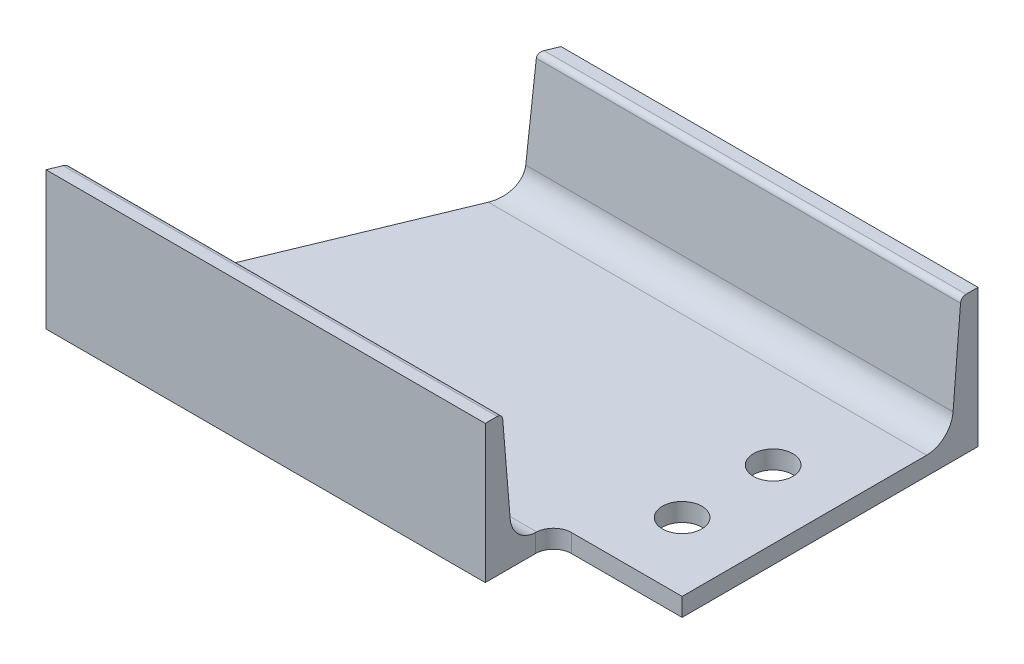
SolidWorks part; units mm, degrees
ref_plane "Front Plane" through (0, 0, 0) normal (0, 0, 1) x (1, 0, 0)
ref_plane "Top Plane" through (0, 0, 0) normal (0, 1, 0) x (1, 0, 0)
ref_plane "Right Plane" through (0, 0, 0) normal (1, 0, 0) x (0, 0, -1)
ref_plane "Member Plane" through (0, 0, 0) normal (0, 1, 0) x (-1, 0, 0)
sketch "Member Sketch" plane through (0, 0, 0) normal (0, 1, 0) x (1, 0, 0)
  line L0 (0, 0) -> (345, 0)
  line L2 (0, 0) -> (345, 0) construction
other "Structural Member1"
ref_plane "Plane1" through (0, 0, -101.6) normal (1, 0, 0) x (0, 1, 0)
sketch "Sketch1" plane through (0, 0, -101.6) normal (1, 0, 0) x (0, 1, 0)
  line L0 (0, 101.6) -> (0, -101.6)
  line L1 (76.962, 0) -> (0, 0) construction
  line L2 (0, 101.6) -> (76.962, 101.6)
  line L3 (74.1364, 91.8509) -> (23.7715, 87.6826)
  line L4 (10.16, 72.898) -> (10.16, -72.898)
  line L5 (76.962, 101.6) -> (76.962, 94.92)
  line L6 (76.962, -101.6) -> (76.962, -94.92)
  line L7 (74.1364, -91.8509) -> (23.7715, -87.6826)
  line L8 (0, -101.6) -> (76.962, -101.6)
  line L9 (38.481, 101.6) -> (38.481, -101.6) construction
  line L11 (76.962, 92.0848) -> (76.962, -92.0848) construction
  arc A0 (10.16, -72.898) -> (23.7715, -87.6826) centre (24.9952, -72.898) ccw
  arc A1 (10.16, 72.898) -> (23.7715, 87.6826) centre (24.9952, 72.898) cw
  arc A2 (76.962, -94.92) -> (74.1364, -91.8509) centre (73.8824, -94.92) ccw
  arc A3 (74.1364, 91.8509) -> (76.962, 94.92) centre (73.8824, 94.92) ccw
  point P2 (38.481, 88.9)
  point P10 (10.16, 0)
  point P17 (0, 0)
  point P19 (10.16, -101.6)
  point P20 (0, -85.7152)
  point P21 (0, 85.7152)
  point P22 (10.16, 101.6)
  point P31 (38.481, 0)
  dimension "D1" = 4.731
  dimension "D2" = 3.0796
  dimension "D3" = 14.8352
  dimension "Section Depth(D)" = 203.2
  dimension "Flange Width(B)" = 76.962
  dimension "Web Thickness(tw)" = 10.16
  dimension "Flange Thickness(Tf)" = 12.7
  dimension "Flange to fillet toe(Kdes)" = 28.702
ref_plane "Plane2" through (0, 0, 0) normal (-0.9239, 0, -0.3827) x (-0.3827, 0, 0.9239)
other "Trim/Extend1"
other "0008-AABE002-CN02-FP03D02-1 - MEMBER2 CAVITY"
other "0008-AABE002<1>@0008-AA/0008-AABE002-CN02-FP03<1>@0008-AABE002/0008-AABE002-CN02-FP03D02<1>@0008-AABE002-CN02-FP031"
other "0008-AABE002-CN02-FP03D01-1 - MEMBER2 CAVITY"
other "0008-AABE002<1>@0008-AA/0008-AABE002-CN02-FP03<1>@0008-AABE002/0008-AABE002-CN02-FP03D01<1>@0008-AABE002-CN02-FP031"
